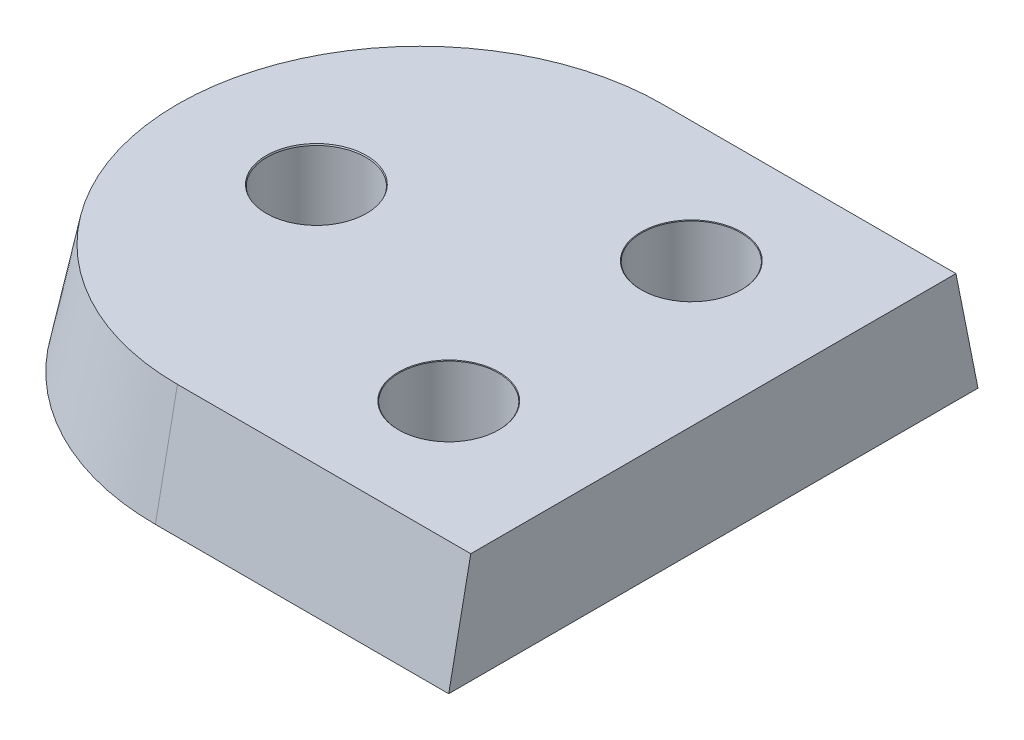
SolidWorks part; units mm, degrees
ref_plane "Front Plane" through (0, 0, 0) normal (0, 0, 1) x (1, 0, 0)
ref_plane "Top Plane" through (0, 0, 0) normal (0, 1, 0) x (1, 0, 0)
ref_plane "Right Plane" through (0, 0, 0) normal (1, 0, 0) x (0, 0, -1)
sketch "Sketch1" plane through (0, 0, 0) normal (0, 1, 0) x (1, 0, 0)
  line L0 (13.3, 12) -> (13.3, -12)
  line L1 (13.3, -12) -> (0, -12)
  line L2 (13.3, 12) -> (0, 12)
  arc A0 (0, 12) -> (0, -12) centre (0, 0) ccw
  point P5 (-12, 0)
  point P6 (13.3, 0)
  dimension "D1" = 25.3
  dimension "D2" = 24
extrude "Boss-Extrude1" add sketch "Sketch1" along normal blind 5
chamfer "Chamfer3" distance 5 distance2 1 3 edges at (6.65, 5, -12) (6.65, 5, 12) (-12, 5, 0)
hole_wizard "M4 Clearance Hole1" positions "Sketch3" profile "Sketch4" hole size "M4" standard "ISO"
sketch "Sketch3" plane through (0, 5, 0) normal (0, 1, 0) x (1, 0, 0)
  line L0 (13.3, -11) -> (13.3, 11) construction
  line L1 (0, 0) -> (19.0805, 0) construction
  point P0 (6.8, 5.5)
  point P2 (6.8, -5.5)
  dimension "D1" = 11
  dimension "D2" = 6.5
  dimension "D3" = 5.5
sketch "Sketch4" plane through (6.8, 5, -5.5) normal (1, 0, 0) x (0, 0, 1)
  line L0 (0, 0) -> (0, 5)
  line L1 (0, 5) -> (2.25, 5)
  line L2 (2.25, 5) -> (2.25, 0.025)
  line L3 (2.25, 0.025) -> (2.275, 0)
  line L5 (2.275, 0) -> (0, 0)
  line L6 (-2.25, 0.025) -> (-2.275, 0) construction
  line L11 (0, -6.35) -> (0, 107.95) construction
  dimension "Thru Hole Dia." = 4.5
  dimension "Thru Hole Depth" = 5
  dimension "Near C'Sink Dia." = 4.55
  dimension "Near C'Sink Angle" = 90
hole_wizard "M4 Clearance Hole2" positions "Sketch5" profile "Sketch6" hole size "M4" standard "DIN"
sketch "Sketch5" plane through (0, 5, 0) normal (0, 1, 0) x (1, 0, 0)
  line L0 (13.3, -11) -> (13.3, 11) construction
  point P2 (-4.7, 0)
  dimension "D1" = 18
sketch "Sketch6" plane through (-4.7, 5, 0) normal (1, 0, 0) x (0, 0, 1)
  line L0 (0, 0) -> (0, 5)
  line L1 (0, 5) -> (2.25, 5)
  line L2 (2.25, 5) -> (2.25, 0.0604)
  line L3 (2.25, 0.0604) -> (2.275, 0)
  line L5 (2.275, 0) -> (0, 0)
  line L6 (-2.25, 0.0604) -> (-2.275, 0) construction
  line L11 (0, -6.35) -> (0, 107.95) construction
  dimension "Thru Hole Dia." = 4.5
  dimension "Thru Hole Depth" = 5
  dimension "Near C'Sink Dia." = 4.55
  dimension "Near C'Sink Angle" = 45
